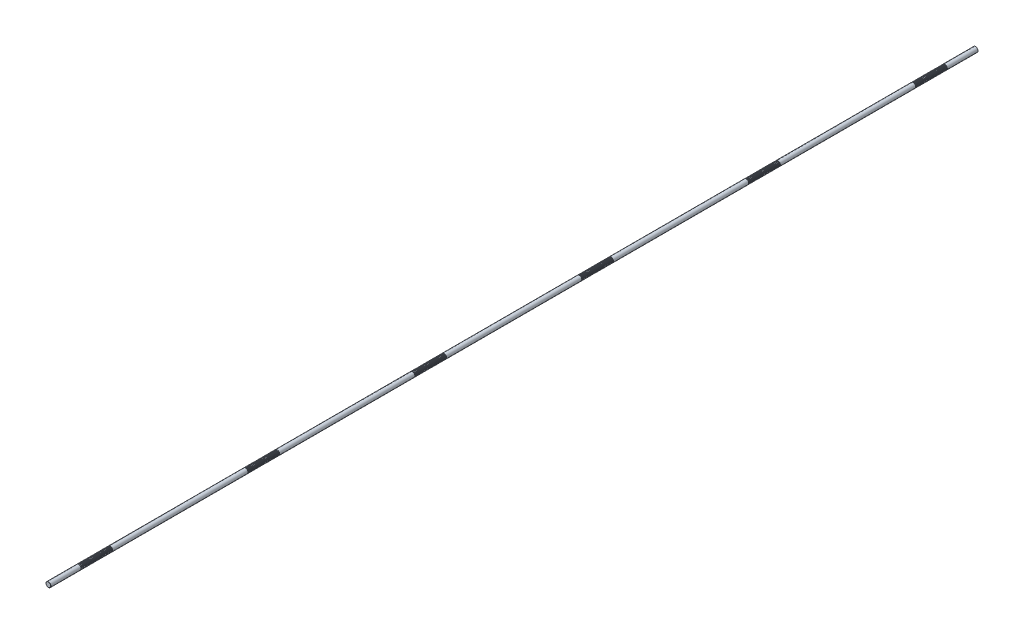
SolidWorks part; units mm, degrees
ref_plane "Front Plane" through (0, 0, 0) normal (0, 0, 1) x (1, 0, 0)
ref_plane "Top Plane" through (0, 0, 0) normal (0, 1, 0) x (1, 0, 0)
ref_plane "Right Plane" through (0, 0, 0) normal (1, 0, 0) x (0, 0, -1)
sketch "Sketch1" plane through (0, 0, 0) normal (0, 0, 1) x (1, 0, 0)
  circle A0 centre (0, 0) radius 8
  dimension "D1" = 16
extrude "Boss-Extrude1" add sketch "Sketch1" along normal mid plane 3000
chamfer "Chamfer1" distance 0.4 angle 45 2 edges at (8, 0, -1500) (8, 0, 1500)
sketch "Sketch2" plane through (0, 0, 0) normal (1, 0, 0) x (0, 0, -1)
  line L0 (1400.3014, 8) -> (1397.6986, 8)
  line L1 (1499.6, 8) -> (-1499.6, 8) construction
  line L2 (1397.6986, 8) -> (1398.3014, 5.75)
  line L3 (1398.3014, 5.75) -> (1399.6986, 5.75)
  line L4 (1399.6986, 5.75) -> (1400.3014, 8)
  line L5 (1500, -7.6) -> (1500, 7.6) construction
  point P4 (1399, 8)
  point P7 (1399, 5.75)
  point P8 (1400, 6.875)
  point P9 (1398, 6.875)
  dimension "D1" = 2
  dimension "D2" = 100
  dimension "D3" = 2.25
  dimension "D4" = 30
revolve "Cut-Revolve1" cut sketch "Sketch2" angle 360 about axis through (0, 0, 1500) along (0, 0, -1)
pattern_linear "LPattern1" count 26 spacing 4 along (0, 0, 1) of "Cut-Revolve1"
pattern_linear "LPattern2" count 6 spacing 540 along (0, 0, 1) of "Cut-Revolve1", "LPattern1"
